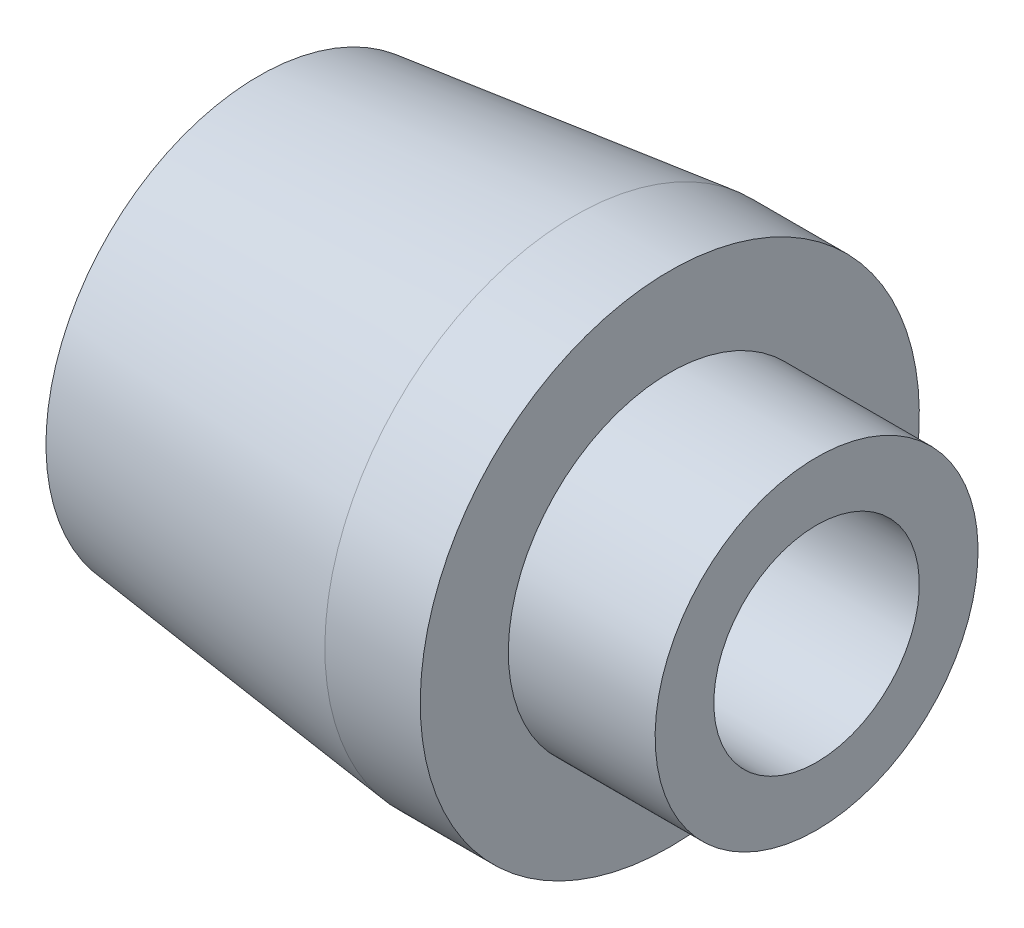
SolidWorks part; units mm, degrees
ref_plane "Plan1" through (0, 0, 0) normal (0, 0, 1) x (1, 0, 0)
ref_plane "Plan2" through (0, 0, 0) normal (0, 1, 0) x (1, 0, 0)
ref_plane "Plan3" through (0, 0, 0) normal (1, 0, 0) x (0, 0, -1)
sketch "Esquisse1" plane through (0, 0, 0) normal (0, 0, 1) x (1, 0, 0)
  line L0 (-90, 0) -> (90, 0) construction
  line L1 (10, 11) -> (0, 11)
  line L2 (0, 11) -> (0, 17)
  line L3 (0, 17) -> (-6.5, 17)
  line L4 (-6.5, 17) -> (-28, 14.5)
  line L5 (-28, 14.5) -> (-28, 7)
  line L6 (-28, 7) -> (10, 7)
  line L7 (10, 7) -> (10, 11)
  dimension "D1" = 14
  dimension "D2" = 22
  dimension "D3" = 10
  dimension "D4" = 34
  dimension "D5" = 28
  dimension "D6" = 29
  dimension "D7" = 6.5
revolve "Base-Révolution" add sketch "Esquisse1" angle 360 about L0
